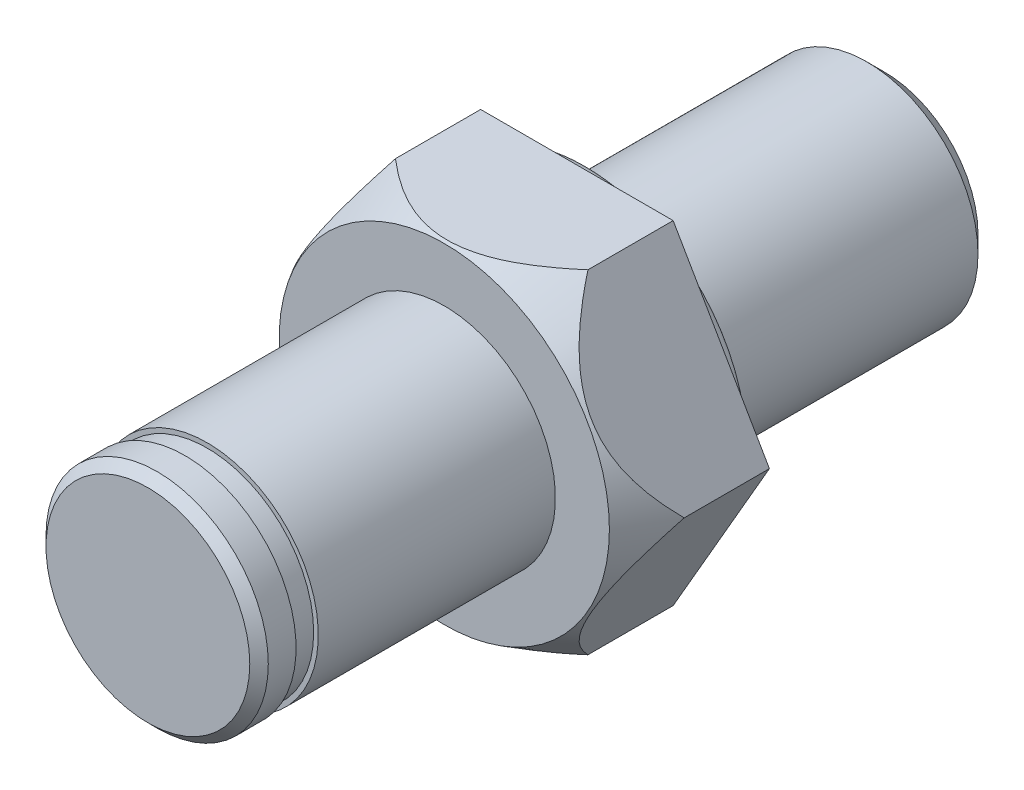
SolidWorks part; units mm, degrees
ref_plane "Face" through (0, 0, 0) normal (0, 0, 1) x (1, 0, 0)
ref_plane "Dessus" through (0, 0, 0) normal (0, 1, 0) x (1, 0, 0)
ref_plane "Droite" through (0, 0, 0) normal (1, 0, 0) x (0, 0, -1)
imported_body "Importée1"
sketch "Esquisse1" plane through (0, 0, 7.16) normal (0, 0, 1) x (1, 0, 0)
  circle A0 centre (0, 0) radius 6
  dimension "D1" = 12
extrude "Boss.-Extru.1" add sketch "Esquisse1" along normal blind 16
chamfer "Chanfrein1" distance 0.5 angle 45 1 edges at (6, 0, 23.16)
sketch "Esquisse2" plane through (0, 0, 0) normal (1, 0, 0) x (0, 0, -1)
  line L0 (-7.16, 6) -> (-22.66, 6) construction
  line L1 (0, 0) -> (-23.5578, 0) construction
  line L2 (-21.16, 6) -> (-21.16, 5.75)
  line L3 (-21.16, 5.75) -> (-19.96, 5.75)
  line L4 (-19.96, 6) -> (-19.96, 5.75)
  line L5 (-19.96, 6) -> (-21.16, 6)
  line L6 (15.6528, 0) -> (16.6, 0) construction
  line L9 (-23.16, 5.5) -> (-23.16, -5.5) construction
  dimension "D1" = 2
  dimension "D2" = 1.2
  dimension "D3" = 11.5
revolve "Enlèvement de matière-Révolution1" cut sketch "Esquisse2" angle 360 about L1
